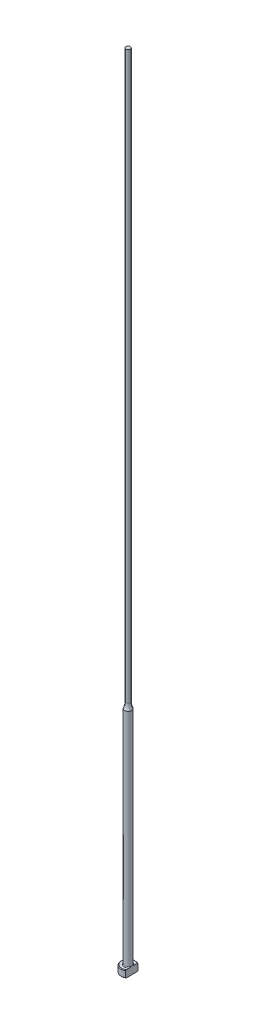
SolidWorks part; units mm, degrees
ref_plane "Front Plane" through (0, 0, 0) normal (0, 0, 1) x (1, 0, 0)
ref_plane "Top Plane" through (0, 0, 0) normal (0, 1, 0) x (1, 0, 0)
ref_plane "Right Plane" through (0, 0, 0) normal (1, 0, 0) x (0, 0, -1)
sketch "Sketch1" plane through (0, 0, 0) normal (0, 0, 1) x (1, 0, 0)
  line L0 (0, 259.9588) -> (0, -15.1925) construction
  line L1 (0, 0) -> (-3.175, 0)
  line L2 (-3.175, 0) -> (-3.175, 3.175)
  line L3 (-3.175, 3.175) -> (-1.5875, 3.175)
  line L4 (-0.9919, 104.2851) -> (-0.9919, 355.6)
  line L5 (-0.9919, 355.6) -> (0, 355.6)
  line L6 (0, 355.6) -> (0, 0)
  line L7 (-1.5875, 3.175) -> (-1.5875, 101.6)
  arc A0 (-1.5875, 101.6) -> (-0.9919, 104.2851) centre (-7.3419, 104.2851) ccw
  point P13 (-1.5875, 0)
  dimension "D1" = 6.35
  dimension "L" = 355.6
  dimension "D2" = 3.175
  dimension "H" = 6.35
  dimension "T" = 3.175
  dimension "D" = 1.9837
  dimension "S" = 101.6
revolve "Revolve1" add sketch "Sketch1" angle 360 about L0
chamfer "Chamfer1" distance 0.254 angle 45 2 edges at (0, 3.175, 3.175) (0, 0, 3.175)
fillet "Fillet1" radius 0.254 1 edges at (0, 3.175, 1.5875)
sketch "Sketch2" plane through (0, 0, 0) normal (0, 1, 0) x (1, 0, 0)
  line L0 (1.5875, -2.7496) -> (1.5875, 2.7496)
  circle A0 centre (0, 0) radius 3.175 construction
  arc A2 (1.5875, -2.7496) -> (1.5875, 2.7496) centre (0, 0) ccw
  circle A3 centre (0, 0) radius 3.175 construction
  circle A4 centre (0, 0) radius 1.5875 construction
extrude "Key Head" cut sketch "Sketch2" along normal up to next
